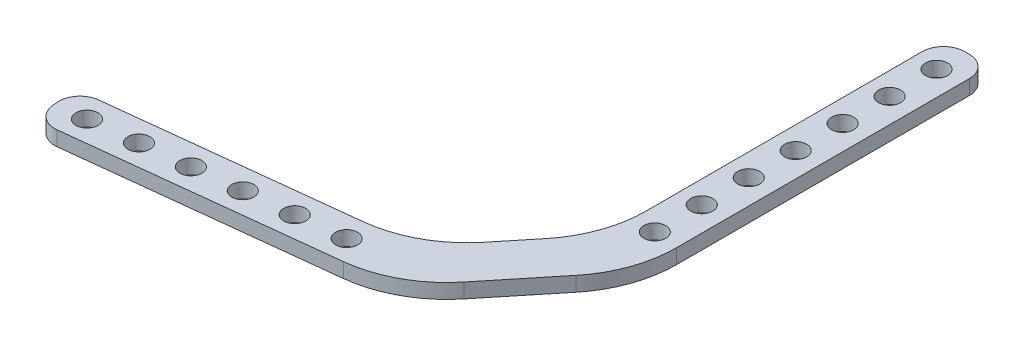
SolidWorks part; units mm, degrees
ref_plane "Front Plane" through (0, 0, 0) normal (0, 0, 1) x (1, 0, 0)
ref_plane "Top Plane" through (0, 0, 0) normal (0, 1, 0) x (1, 0, 0)
ref_plane "Right Plane" through (0, 0, 0) normal (1, 0, 0) x (0, 0, -1)
sketch "Sketch1" plane through (0, 0, 0) normal (0, 1, 0) x (1, 0, 0)
  line L0 (0, 0) -> (0, 72.3752)
  line L1 (-5.3103, 78.0723) -> (-5.3103, 61.6351) construction
  line L2 (-90.0633, -30.8926) -> (-51.5144, -26.5414) construction
  line L8 (-23.114, -28.448) -> (0, 0)
  line L9 (-89.0786, -35.8937) -> (-23.114, -28.448)
  line L10 (-94.2485, -30.8538) -> (-94.1345, -31.8634)
  line L11 (-28.3804, -18.8179) -> (-90.2182, -25.7979)
  line L12 (-10.16, 3.6072) -> (-28.3804, -18.8179)
  line L13 (-10.16, 72.3752) -> (-10.16, 3.6072)
  line L14 (-4.572, 76.9472) -> (-5.588, 76.9472)
  circle A0 centre (-87.8816, -30.6464) radius 2.3812
  circle A1 centre (-77.7857, -29.5068) radius 2.3813
  circle A2 centre (-67.6898, -28.3672) radius 2.3812
  circle A3 centre (-57.5939, -27.2277) radius 2.3812
  arc A4 (0, 72.3752) -> (-4.572, 76.9472) centre (-4.572, 72.3752) ccw
  arc A5 (-5.588, 76.9472) -> (-10.16, 72.3752) centre (-5.588, 72.3752) ccw
  arc A6 (-90.2182, -25.7979) -> (-94.2485, -30.8538) centre (-89.7054, -30.341) ccw
  arc A7 (-94.1345, -31.8634) -> (-89.0786, -35.8937) centre (-89.5914, -31.3506) ccw
  circle A8 centre (-47.498, -26.0881) radius 2.3812
  circle A9 centre (-5.3103, 70.5972) radius 2.3812
  circle A10 centre (-5.3103, 60.4372) radius 2.3812
  circle A11 centre (-5.3103, 50.2772) radius 2.3812
  circle A12 centre (-5.3103, 40.1172) radius 2.3812
  circle A13 centre (-5.3103, 29.9572) radius 2.3813
  circle A14 centre (-5.3103, 19.7972) radius 2.3813
  circle A15 centre (-37.4022, -24.9485) radius 2.3813
  circle A16 centre (-5.3103, 9.6372) radius 2.3812
  point P34 (-94.8773, -35.2336)
  dimension "D4" = 4.572
  dimension "D10" = 6.35
  dimension "D11" = 6.35
  dimension "D12" = 7
  dimension "D13" = 4.7625
  dimension "D1" = 76.9472
  dimension "D2" = 23.114
  dimension "D3" = 5.08
  dimension "D5" = 10.16
  dimension "D6" = 96.44
  dimension "D7" = 28.448
  dimension "D8" = 10.16
  dimension "D9" = 10.16
  dimension "D14" = 6
extrude "Boss-Extrude1" add sketch "Sketch1" along normal blind 3.175
fillet "Fillet1" radius 25.4 4 edges at (-10.16, 1.5875, -3.6072) (-28.3804, 1.5875, 18.8179) (0, 1.5875, 0) (-23.114, 1.5875, 28.448)
